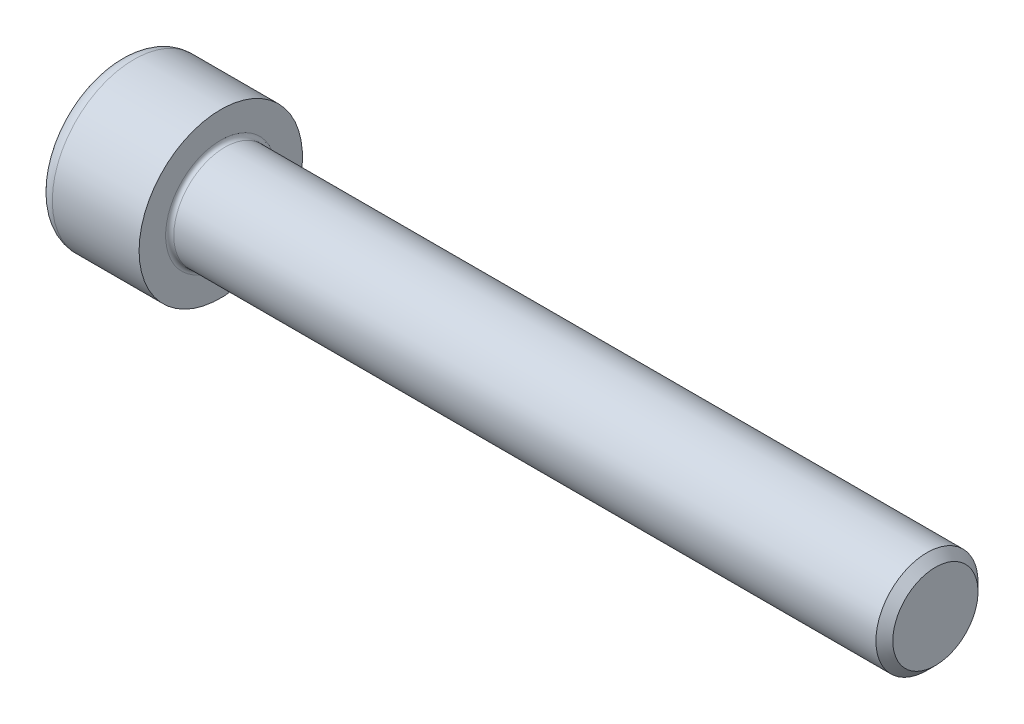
SolidWorks part; units mm, degrees
ref_plane "Plane1" through (0, 0, 0) normal (0, 0, 1) x (1, 0, 0)
ref_plane "Plane2" through (0, 0, 0) normal (0, 1, 0) x (1, 0, 0)
ref_plane "Plane3" through (0, 0, 0) normal (1, 0, 0) x (0, 0, -1)
revolve "Base-Revolve" add sketch "BodySke"
sketch "BodySke" plane through (0, 0, 0) normal (0, 0, 1) x (1, 0, 0)
  line L0 (0, 0) -> (0, 8)
  line L1 (0, 8) -> (10, 8)
  line L2 (10, 8) -> (10, 5)
  line L3 (10, 5) -> (79.172, 5)
  line L4 (80, 4.172) -> (80, 0)
  line L5 (80, 0) -> (0, 0)
  line L6 (-31.75, 0) -> (127, 0) construction
  line L8 (80, 4.172) -> (79.172, 5)
  line L10 (80, -4.172) -> (79.172, -5) construction
  line L11 (11.5, 9.525) -> (11.5, 3.175) construction
  line L12 (20, 9.525) -> (20, 3.175) construction
  line L13 (20, 9.525) -> (20, 3.175) construction
  dimension "Diameter" = 10
  dimension "Head_ht" = 10
  dimension "Length" = 70
  dimension "Body_ch_ang" = 45
  dimension "Head_dia" = 16
  dimension "Minor_dia" = 8.344
  dimension "Advance" = 1.5
  dimension "Thread_nom" = 60
  dimension "Thread_length" = 60
fillet "Fillet1" radius 0.4 1 edges at (10, 0, 5)
fillet "Fillet2" radius 1.5 1 edges at (0, 0, 8)
sketch "Sketch2" plane through (0, 0, 0) normal (0, 0, 1) x (1, 0, 0)
  line L0 (0, 4.0575) -> (5, 4.0575)
  line L1 (5, 4.0575) -> (7.3426, 0)
  line L2 (-31.75, 0) -> (127, 0) construction
  line L3 (7.3426, 0) -> (0, 0)
  line L4 (0, 0) -> (0, 4.0575)
  line L6 (0, 0) -> (47.625, 0) construction
  dimension "D1" = 4.0575
  dimension "D2" = 60
  dimension "Depth" = 5
revolve "Hex-PreBroach" cut sketch "Sketch2" angle 360 about L6
sketch "Sketch3" plane through (0, 0, 0) normal (-1, 0, 0) x (0, 0.5, 0.866)
  line L0 (2.3426, 4.0575) -> (-2.3426, 4.0575)
  line L1 (-2.3426, 4.0575) -> (-4.6852, 0)
  line L2 (2.3426, 4.0575) -> (4.6852, 0)
  line L3 (2.3426, -4.0575) -> (4.6852, 0)
  line L4 (2.3426, -4.0575) -> (-2.3426, -4.0575)
  line L5 (-2.3426, -4.0575) -> (-4.6852, 0)
  dimension "D1" = 4.0575
  dimension "D2" = 4.0575
  dimension "Hex_size" = 8.115
extrude "Hex" cut sketch "Sketch3" against normal blind 5
sketch "ThdSchSke" plane through (0, 0, 0) normal (0, 0, 1) x (1, 0, 0)
  line L0 (20, -4.172) -> (19.4202, -5)
  line L1 (20, -4.172) -> (20.5798, -5)
  line L2 (20.5798, -5) -> (20.5798, -6.25)
  line L3 (-3.175, 0) -> (5.1513, 0) construction
  line L4 (0, 6.5) -> (0, -6.5) construction
  line L5 (20.5798, -6.25) -> (19.4202, -6.25)
  line L6 (19.4202, -6.25) -> (19.4202, -5)
  dimension "Thread_minor" = 8.344
  dimension "Diameter" = 10
  dimension "Start" = 20
  dimension "SideAngle" = 55
  dimension "VeeAngle" = 70
  dimension "Overcut" = 12.5
revolve "ThreadSchematic" cut sketch "ThdSchSke" angle 360 about L3
pattern_linear "ThdSchPat"
equation "\"D2@Sketch3\" = \"Hex_size@Sketch3\" / 2"
equation "\"D1@Sketch3\" = \"Hex_size@Sketch3\" / 2"
equation "\"D1@Sketch2\" = \"Hex_size@Sketch3\" / 2"
equation "\"Thread_minor@ThreadCosmetic\"  =  \"Minor_dia@BodySke\""
equation "\"Depth@Sketch2\" =  \"Key_eng@Hex\""
equation "\"Thread_length@ThreadCosmetic\" = ((sgn( (\"Length@BodySke\" - \"Advance@BodySke\" * 3.0) - \"Thread_nom@BodySke\" )-1)*( (\"Length@BodySke\" - \"Advance@BodySke\" * 3.0) - \"Thread_nom@BodySke\" ))/-2+ \"Thread_no"
equation "\"Thread_minor@ThdSchSke\" = \"Minor_dia@BodySke\""
equation "\"Diameter@ThdSchSke\" = \"Diameter@BodySke\""
equation "\"Overcut@ThdSchSke\" = \"Diameter@BodySke\" * 1.25"
equation "\"Start@ThdSchSke\" = \"Head_ht@BodySke\" + \"Length@BodySke\" - \"Thread_length@ThreadCosmetic\"  '---Non-countersunk---"
equation "\"Num_threads@ThdSchPat\" = int( \"Thread_length@ThreadCosmetic\" / \"Advance@BodySke\" + 0.999 )  + 1"
equation "\"Advance@ThdSchPat\" = \"Thread_length@ThreadCosmetic\" /  (\"Num_threads@ThdSchPat\" - 1) 'relax it"
equation "\"Num_threads@ThdSchPat\" = \"Num_threads@ThdSchPat\" - sgn( \"Num_threads@ThdSchPat\" - 1) '---chamfered tips only---"
